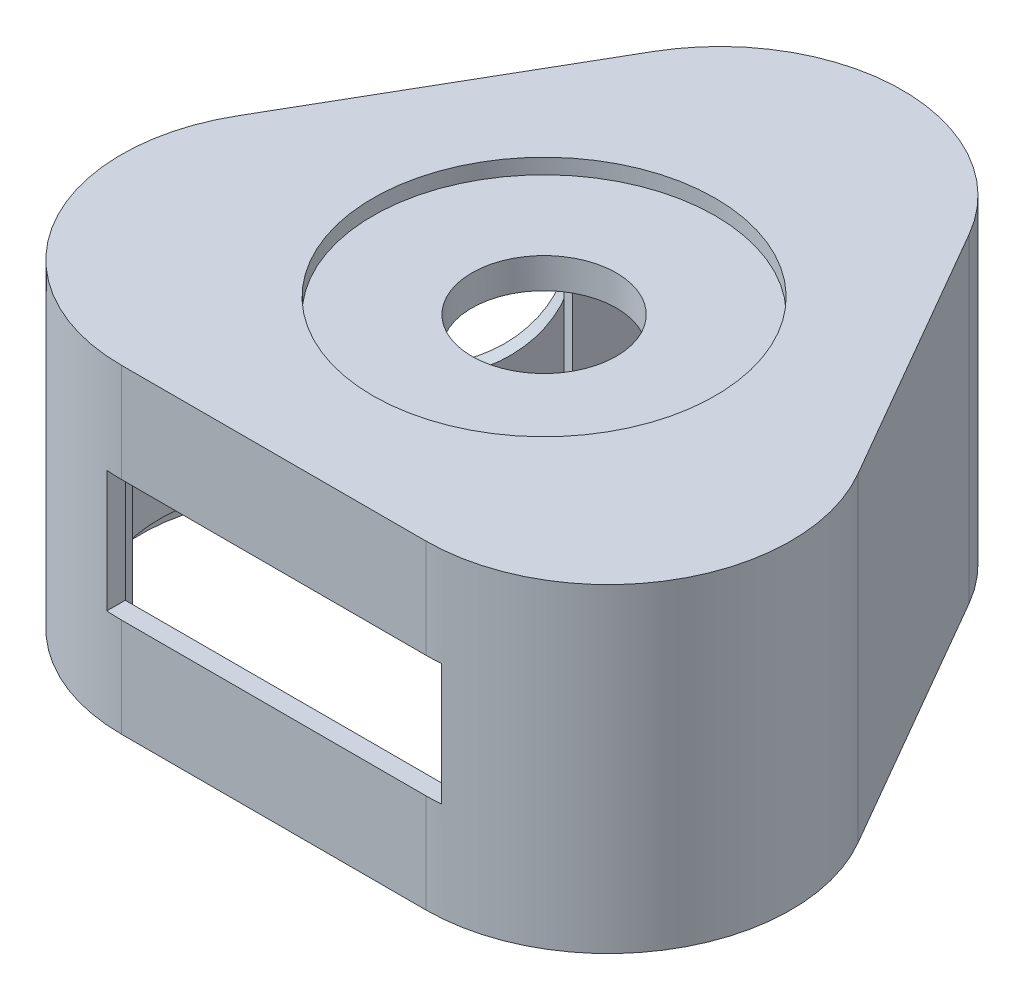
SolidWorks part; units mm, degrees
ref_plane "Спереди" through (0, 0, 0) normal (0, 0, 1) x (1, 0, 0)
ref_plane "Сверху" through (0, 0, 0) normal (0, 1, 0) x (1, 0, 0)
ref_plane "Справа" through (0, 0, 0) normal (1, 0, 0) x (0, 0, -1)
sketch "Эскиз1" plane through (0, 0, 0) normal (0, 1, 0) x (1, 0, 0)
  line L0 (0, 0) -> (0, 11.547) construction
  line L1 (0, 0) -> (10, -5.7735) construction
  line L2 (0, 0) -> (-10, -5.7735) construction
  line L3 (10.3923, 17.547) -> (20.3923, 0.2265)
  line L4 (10, -17.7735) -> (-10, -17.7735)
  line L5 (-10.3923, 17.547) -> (-20.3923, 0.2265)
  arc A0 (-10.3923, 17.547) -> (10.3923, 17.547) centre (0, 11.547) cw
  arc A1 (20.3923, 0.2265) -> (10, -17.7735) centre (10, -5.7735) cw
  arc A2 (-20.3923, 0.2265) -> (-10, -17.7735) centre (-10, -5.7735) ccw
  dimension "D1" = 12
  dimension "D5" = 41.3205
  dimension "D6" = 44
  dimension "D2" = 120
  dimension "D3" = 120
  dimension "D4" = 20
extrude "Бобышка-Вытянуть1" add sketch "Эскиз1" along normal blind 21
sketch "Эскиз2" plane through (0, 0, 0) normal (0, -1, 0) x (1, 0, 0)
  line L0 (-10, 15.2735) -> (10, 15.2735)
  line L1 (18.2272, 1.0235) -> (8.2272, -16.297)
  line L2 (18.2272, 10.5235) -> (-15.3923, -8.8868) construction
  line L4 (-8.2272, -16.297) -> (-18.2272, 1.0235)
  line L6 (-10.3923, -17.547) -> (-20.3923, -0.2265) construction
  arc A0 (18.2272, 1.0235) -> (10, 15.2735) centre (10, 5.7735) ccw
  arc A1 (-10, 15.2735) -> (-18.2272, 1.0235) centre (-10, 5.7735) ccw
  arc A2 (-8.2272, -16.297) -> (8.2272, -16.297) centre (0, -11.547) ccw
  arc A3 (20.3923, -0.2265) -> (10, 17.7735) centre (10, 5.7735) ccw construction
  arc A4 (-10, 17.7735) -> (-20.3923, -0.2265) centre (-10, 5.7735) ccw construction
  arc A5 (-10.3923, -17.547) -> (10.3923, -17.547) centre (0, -11.547) ccw construction
  dimension "D1" = 19
extrude "Вырез-Вытянуть1" cut sketch "Эскиз2" against normal offset from surface (18 mm away) 3
sketch "Эскиз3" plane through (0, 0, 0) normal (0, -1, 0) x (1, 0, 0)
  line L12 (9.3098, -16.922) -> (19.3098, 0.3985)
  line L13 (10, 16.5235) -> (-10, 16.5235)
  line L14 (-19.3098, 0.3985) -> (-9.3098, -16.922)
  line L15 (9.3098, -16.922) -> (19.3098, 0.3985)
  line L16 (10, 16.5235) -> (-10, 16.5235)
  line L17 (-19.3098, 0.3985) -> (-9.3098, -16.922)
  arc A15 (19.3098, 0.3985) -> (10, 16.5235) centre (10, 5.7735) ccw
  arc A16 (-10, 16.5235) -> (-19.3098, 0.3985) centre (-10, 5.7735) ccw
  arc A17 (-9.3098, -16.922) -> (9.3098, -16.922) centre (0, -11.547) ccw
  arc A18 (19.3098, 0.3985) -> (10, 16.5235) centre (10, 5.7735) ccw
  arc A19 (-10, 16.5235) -> (-19.3098, 0.3985) centre (-10, 5.7735) ccw
  arc A20 (-9.3098, -16.922) -> (9.3098, -16.922) centre (0, -11.547) ccw
  dimension "D1" = 1.25
extrude "Вырез-Вытянуть2" cut sketch "Эскиз3" against normal blind 1.5
sketch "Эскиз4" plane through (0, 18, 0) normal (0, -1, 0) x (1, 0, 0)
  circle A0 centre (0, 0) radius 4.75
  dimension "D1" = 9.5
extrude "Вырез-Вытянуть3" cut sketch "Эскиз4" against normal through all
sketch "Эскиз5" plane through (-15.3923, 0, -8.8868) normal (-0.866, 0, -0.5) x (-0.5, 0, 0.866)
  line L0 (0, 0) -> (0, 11.7) construction
  line L1 (-10, 0) -> (10, 0) construction
  line L2 (-10, 21) -> (10, 21) construction
  circle A0 centre (0, 11.7) radius 5.5
  dimension "D1" = 11
  dimension "D2" = 9.3
extrude "Вырез-Вытянуть4" cut sketch "Эскиз5" against normal up to next
sketch "Эскиз7" plane through (0, 21, 0) normal (0, 1, 0) x (1, 0, 0)
  circle A0 centre (0, 0) radius 11.25
  dimension "D1" = 22.5
extrude "Вырез-Вытянуть6" cut sketch "Эскиз7" against normal blind 1
sketch "Эскиз8" plane through (0, 0, 17.7735) normal (0, 0, 1) x (1, 0, 0)
  line L0 (0, 0) -> (0, 21) construction
  line L1 (-10, 21) -> (10, 21) construction
  line L3 (-11, 14.5) -> (11, 14.5)
  line L4 (-11, 14.5) -> (-11, 6.5)
  line L5 (-11, 6.5) -> (11, 6.5)
  line L6 (11, 14.5) -> (11, 6.5)
  dimension "D1" = 8
  dimension "D2" = 22
  dimension "D3" = 6.5
extrude "Вырез-Вытянуть7" cut sketch "Эскиз8" against normal up to next
sketch "Эскиз9" plane through (0, 0, 15.2735) normal (0, 0, -1) x (-1, 0, 0)
  line L0 (10, 14.5) -> (-10, 14.5) construction
  line L1 (12, 4.5) -> (-12, 4.5)
  line L2 (12, 4.5) -> (12, 15.5)
  line L3 (12, 15.5) -> (-12, 15.5)
  line L4 (-12, 4.5) -> (-12, 15.5)
  line L5 (-11, 14.5) -> (-11, 6.5) construction
  line L6 (11, 6.5) -> (11, 14.5) construction
  line L7 (-10, 6.5) -> (10, 6.5) construction
  dimension "D1" = 1
  dimension "D2" = 1
  dimension "D3" = 1
  dimension "D4" = 2
extrude "Вырез-Вытянуть8" cut sketch "Эскиз9" against normal mid plane 2.5
chamfer "Фаска1" distance 1.5 angle 45 1 edges at (-18.1423, 11.7, -4.1236)
sketch "Эскиз10" plane through (0, 18, 0) normal (0, -1, 0) x (1, 0, 0)
  line L0 (0, 0) -> (-13.2272, -7.6368) construction
  line L1 (-8.2272, -16.297) -> (-18.2272, 1.0235) construction
  line L2 (-17.2272, -0.7085) -> (-15.9772, -2.8736)
  line L3 (-9.2272, -14.565) -> (-2.9053, -10.915)
  line L4 (-2.9053, -10.915) -> (-5.1553, -7.0178)
  line L5 (-5.1553, -7.0178) -> (-6.4543, -7.7678)
  line L6 (-6.4543, -7.7678) -> (-5.0793, -10.1494)
  line L7 (-5.0793, -10.1494) -> (-8.1104, -11.8994)
  line L8 (-8.1104, -11.8994) -> (-8.4854, -11.2499)
  line L9 (-8.4854, -11.2499) -> (-10.4772, -12.3999)
  line L10 (-13.9854, -1.7236) -> (-15.9772, -2.8736)
  line L11 (-14.3604, -1.0741) -> (-13.9854, -1.7236)
  line L12 (-11.3293, 0.6759) -> (-14.3604, -1.0741)
  line L13 (-9.9543, -1.7057) -> (-11.3293, 0.6759)
  line L14 (-8.6553, -0.9557) -> (-9.9543, -1.7057)
  line L15 (-10.9053, 2.9415) -> (-8.6553, -0.9557)
  line L16 (-17.2272, -0.7085) -> (-10.9053, 2.9415)
  line L17 (-10.4772, -12.3999) -> (-9.2272, -14.565)
  line L19 (-8.2272, -16.297) -> (-18.2272, 1.0235) construction
  dimension "D1" = 7
  dimension "D2" = 7.3
  dimension "D3" = 3.5
  dimension "D5" = 1.5
  dimension "D6" = 11
  dimension "D7" = 12.5
  dimension "D8" = 16
extrude "Бобышка-Вытянуть2" add sketch "Эскиз10" along normal blind 13.5
